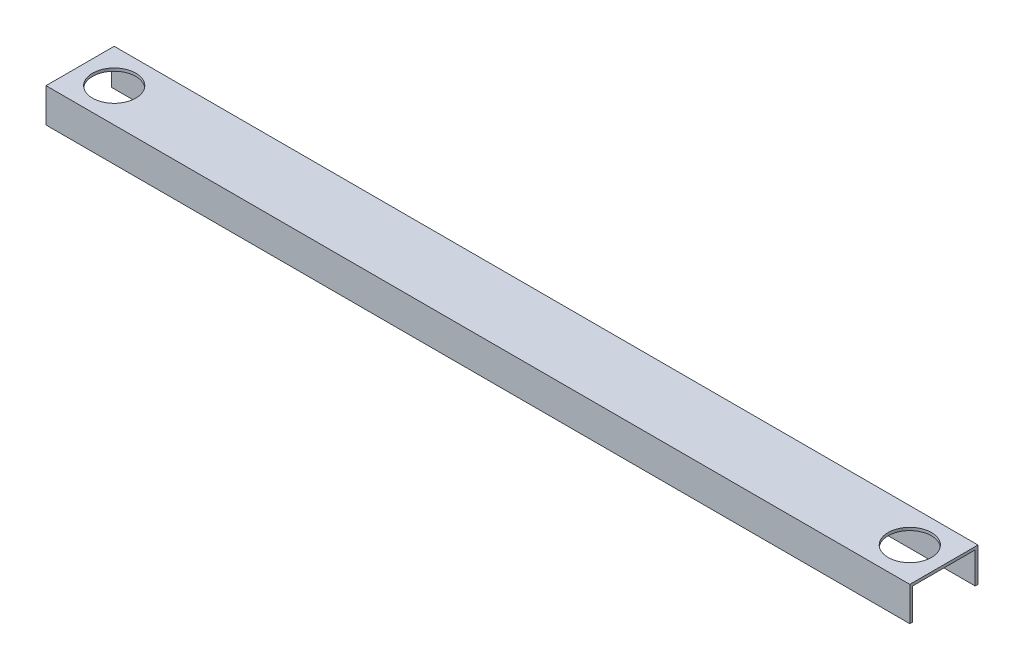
SolidWorks part; units mm, degrees
ref_plane "Front Plane" through (0, 0, 0) normal (0, 0, 1) x (1, 0, 0)
ref_plane "Top Plane" through (0, 0, 0) normal (0, 1, 0) x (1, 0, 0)
ref_plane "Right Plane" through (0, 0, 0) normal (1, 0, 0) x (0, 0, -1)
sketch "Sketch2" plane through (0, 0, 0) normal (1, 0, 0) x (0, 0, -1)
  line L0 (-34.925, 15.875) -> (34.925, 15.875)
  line L1 (-38.1, -19.05) -> (-34.925, -19.05)
  line L2 (-38.1, -19.05) -> (-38.1, 19.05)
  line L3 (-38.1, 19.05) -> (38.1, 19.05)
  line L4 (38.1, -19.05) -> (38.1, 19.05)
  line L5 (-38.1, -19.05) -> (38.1, 19.05) construction
  line L6 (-38.1, 19.05) -> (38.1, -19.05) construction
  line L7 (34.925, -15.875) -> (34.925, 15.875)
  line L9 (-34.925, -15.875) -> (-34.925, 15.875)
  line L10 (-34.925, -15.875) -> (-34.925, -19.05)
  line L11 (34.925, -15.875) -> (34.925, -19.05)
  line L13 (34.925, -19.05) -> (38.1, -19.05)
  line L14 (-34.925, -15.875) -> (34.925, -15.875) construction
  line L16 (-38.1, -19.05) -> (38.1, -19.05) construction
  point P0 (0, 0)
  dimension "D2" = 76.2
  dimension "D3" = 38.1
  dimension "D1" = 3.175
extrude "Extrude1" add sketch "Sketch2" along normal mid plane 965.2
sketch "Sketch3" plane through (0, 19.05, 0) normal (0, 1, 0) x (1, 0, 0)
  line L0 (-598.6196, 0) -> (631.2325, 0) construction
  circle A0 centre (-444.5, 0) radius 24.1935
  dimension "D2" = 48.387
  dimension "D1" = 444.5
extrude "Extrude2" cut sketch "Sketch3" against normal through all
mirror "Mirror1" about plane through (0, 0, 0) normal (1, 0, 0) of "Extrude2"
